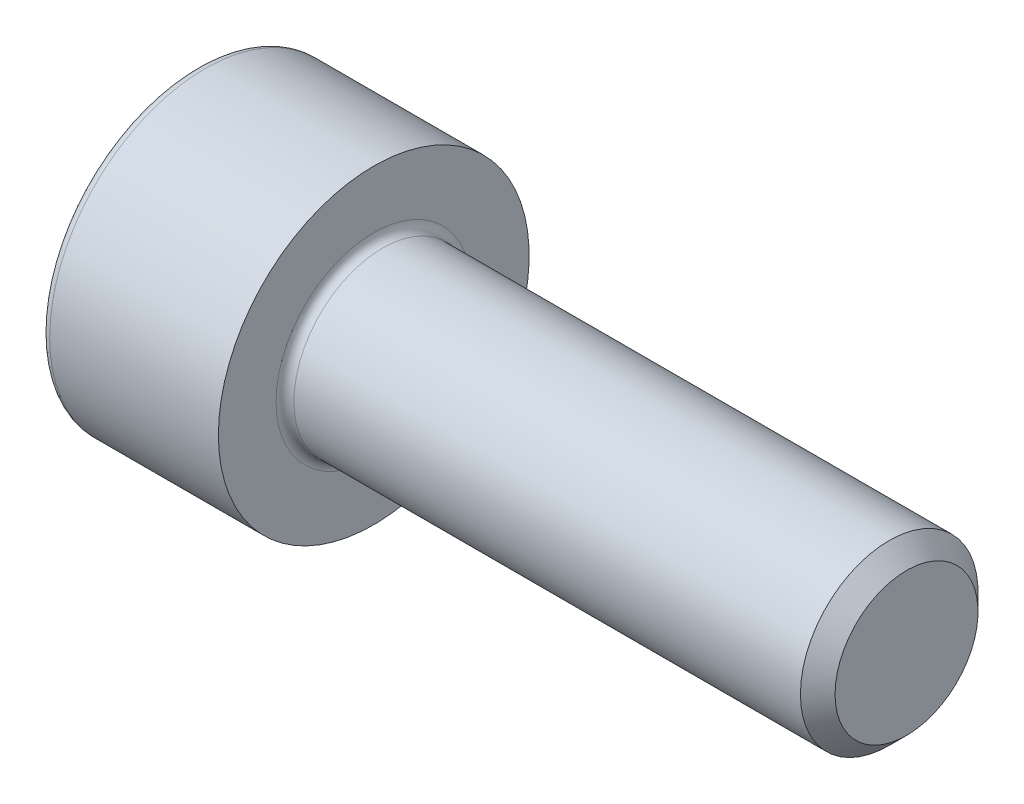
SolidWorks part; units mm, degrees
ref_plane "Plane1" through (0, 0, 0) normal (0, 0, 1) x (1, 0, 0)
ref_plane "Plane2" through (0, 0, 0) normal (0, 1, 0) x (1, 0, 0)
ref_plane "Plane3" through (0, 0, 0) normal (1, 0, 0) x (0, 0, -1)
sketch "BodySke" plane through (0, 0, 0) normal (0, 0, 1) x (1, 0, 0)
  line L0 (0, 0) -> (0, 3.5)
  line L1 (0, 3.5) -> (4, 3.5)
  line L2 (4, 3.5) -> (4, 2)
  line L3 (4, 2) -> (15.61, 2)
  line L4 (16, 1.61) -> (16, 0)
  line L5 (16, 0) -> (0, 0)
  line L6 (-31.75, 0) -> (127, 0) construction
  line L8 (16, 1.61) -> (15.61, 2)
  line L10 (16, -1.61) -> (15.61, -2) construction
  line L11 (4.7, 9.525) -> (4.7, 3.175) construction
  line L12 (4, 9.525) -> (4, 3.175) construction
  line L13 (-44, 9.525) -> (-44, 3.175) construction
  dimension "Diameter" = 4
  dimension "Head_ht" = 4
  dimension "Length" = 12
  dimension "Body_ch_ang" = 45
  dimension "Head_dia" = 7
  dimension "Minor_dia" = 3.22
  dimension "Advance" = 0.7
  dimension "Thread_nom" = 12
  dimension "Thread_length" = 60
revolve "Base-Revolve" add sketch "BodySke"
fillet "Fillet1" radius 0.2 1 edges at (4, 0, 2)
fillet "Fillet2" radius 0.2 1 edges at (0, 0, 3.5)
sketch "Sketch2" plane through (0, 0, 0) normal (0, 0, 1) x (1, 0, 0)
  line L0 (0, 1.5355) -> (2, 1.5355)
  line L1 (2, 1.5355) -> (2.8865, 0)
  line L2 (-31.75, 0) -> (127, 0) construction
  line L3 (2.8865, 0) -> (0, 0)
  line L4 (0, 0) -> (0, 1.5355)
  line L6 (0, 0) -> (47.625, 0) construction
  dimension "D1" = 1.5355
  dimension "D2" = 60
  dimension "Depth" = 2
revolve "Hex-PreBroach" cut sketch "Sketch2" angle 360 about L6
sketch "Sketch3" plane through (0, 0, 0) normal (-1, 0, 0) x (0, 0.5, 0.866)
  line L0 (0.8865, 1.5355) -> (-0.8865, 1.5355)
  line L1 (-0.8865, 1.5355) -> (-1.773, 0)
  line L2 (0.8865, 1.5355) -> (1.773, 0)
  line L3 (0.8865, -1.5355) -> (1.773, 0)
  line L4 (0.8865, -1.5355) -> (-0.8865, -1.5355)
  line L5 (-0.8865, -1.5355) -> (-1.773, 0)
  dimension "D1" = 1.5355
  dimension "D2" = 1.5355
  dimension "Hex_size" = 3.071
extrude "Hex" cut sketch "Sketch3" against normal blind 2
sketch "ThdSchSke" plane through (0, 0, 0) normal (0, 0, 1) x (1, 0, 0)
  line L0 (6.1, -1.61) -> (5.8269, -2)
  line L1 (6.1, -1.61) -> (6.3731, -2)
  line L2 (6.3731, -2) -> (6.3731, -2.5)
  line L3 (-3.175, 0) -> (5.1513, 0) construction
  line L4 (0, 3.3) -> (0, -3.3) construction
  line L5 (6.3731, -2.5) -> (5.8269, -2.5)
  line L6 (5.8269, -2.5) -> (5.8269, -2)
  dimension "Thread_minor" = 3.22
  dimension "Diameter" = 4
  dimension "Start" = 6.1
  dimension "SideAngle" = 55
  dimension "VeeAngle" = 70
  dimension "Overcut" = 5
revolve "ThreadSchematic" [suppressed] cut sketch "ThdSchSke" angle 360 about L3
pattern_linear "ThdSchPat" [suppressed]
equation "\"D2@Sketch3\" = \"Hex_size@Sketch3\" / 2"
equation "\"D1@Sketch3\" = \"Hex_size@Sketch3\" / 2"
equation "\"D1@Sketch2\" = \"Hex_size@Sketch3\" / 2"
equation "\"Thread_minor@ThreadCosmetic\"  =  \"Minor_dia@BodySke\""
equation "\"Depth@Sketch2\" =  \"Key_eng@Hex\""
equation "\"Thread_length@ThreadCosmetic\" = ((sgn( (\"Length@BodySke\" - \"Advance@BodySke\" * 3.0) - \"Thread_nom@BodySke\" )-1)*( (\"Length@BodySke\" - \"Advance@BodySke\" * 3.0) - \"Thread_nom@BodySke\" ))/-2+ \"Thread_no"
equation "\"Thread_minor@ThdSchSke\" = \"Minor_dia@BodySke\""
equation "\"Diameter@ThdSchSke\" = \"Diameter@BodySke\""
equation "\"Overcut@ThdSchSke\" = \"Diameter@BodySke\" * 1.25"
equation "\"Start@ThdSchSke\" = \"Head_ht@BodySke\" + \"Length@BodySke\" - \"Thread_length@ThreadCosmetic\"  '---Non-countersunk---"
equation "\"Num_threads@ThdSchPat\" = int( \"Thread_length@ThreadCosmetic\" / \"Advance@BodySke\" + 0.999 )  + 1"
equation "\"Advance@ThdSchPat\" = \"Thread_length@ThreadCosmetic\" /  (\"Num_threads@ThdSchPat\" - 1) 'relax it"
equation "\"Num_threads@ThdSchPat\" = \"Num_threads@ThdSchPat\" - sgn( \"Num_threads@ThdSchPat\" - 1) '---chamfered tips only---"
